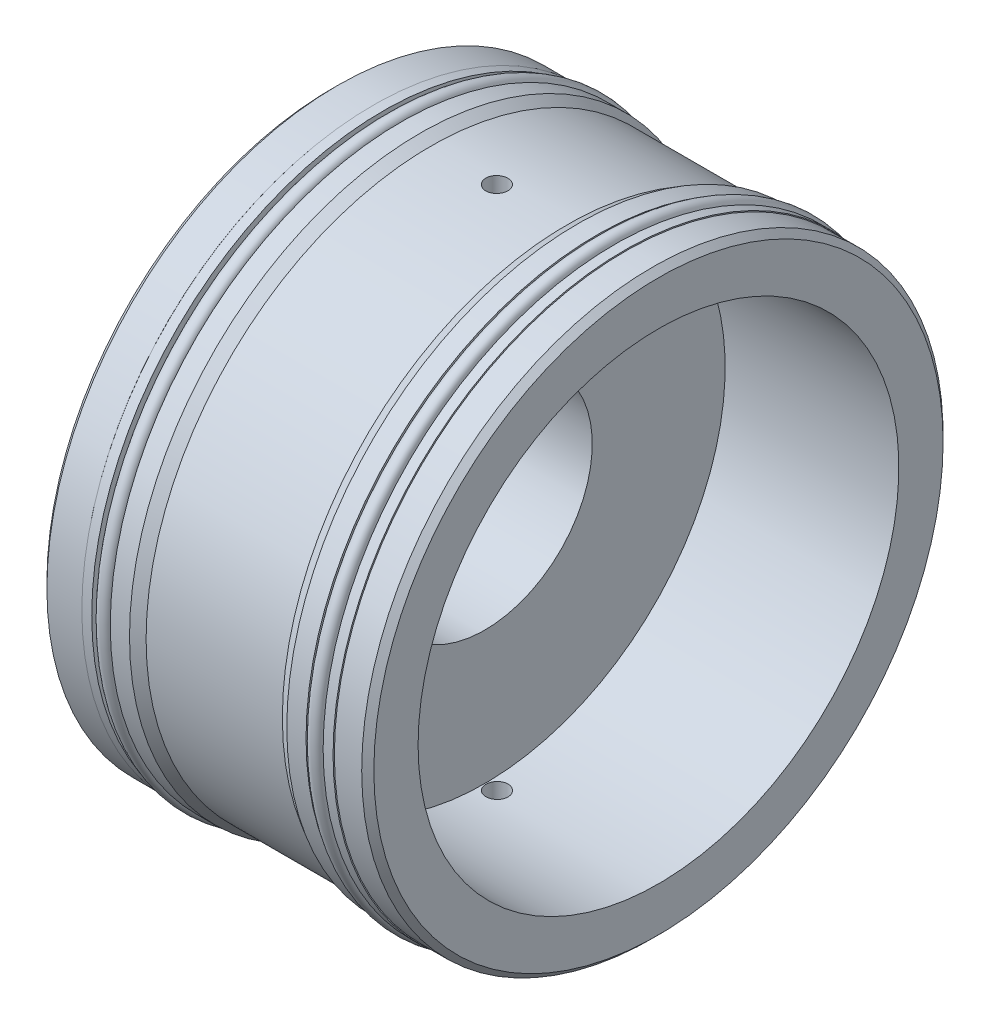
SolidWorks part; units mm, degrees
ref_plane "Front Plane" through (0, 0, 0) normal (0, 0, 1) x (1, 0, 0)
ref_plane "Top Plane" through (0, 0, 0) normal (0, 1, 0) x (1, 0, 0)
ref_plane "Right Plane" through (0, 0, 0) normal (1, 0, 0) x (0, 0, -1)
sketch "Sketch1" plane through (0, 0, 0) normal (0, 0, 1) x (1, 0, 0)
  line L0 (0, 0) -> (0, 45.5562) construction
  line L1 (0, 0) -> (32.8567, 0) construction
  line L2 (-20.5105, 13.4874) -> (-20.5105, 36.4744)
  line L3 (-20.5105, 36.4744) -> (-15.3543, 36.4744)
  line L4 (-15.3543, 36.4744) -> (-15.3543, 35.2171)
  line L5 (-15.3543, 35.2171) -> (-11.7983, 35.2171)
  line L6 (-11.7983, 35.2171) -> (-11.7983, 36.4744)
  line L7 (-11.7983, 36.4744) -> (-9.3853, 36.4744)
  line L8 (-9.3853, 36.4744) -> (-9.3853, 35.7124)
  line L9 (-9.3853, 35.7124) -> (10.3505, 35.7124)
  line L10 (-20.5105, 13.4874) -> (-1.2827, 13.4874)
  line L11 (-1.2827, 13.4874) -> (-1.2827, 30.1625)
  line L12 (-1.2827, 30.1625) -> (20.5105, 30.1625)
  line L13 (10.3505, 36.4744) -> (10.3505, 35.7124)
  line L14 (12.7635, 36.4744) -> (10.3505, 36.4744)
  line L15 (12.7635, 35.2171) -> (12.7635, 36.4744)
  line L16 (16.3195, 35.2171) -> (12.7635, 35.2171)
  line L17 (16.3195, 36.4744) -> (16.3195, 35.2171)
  line L18 (20.5105, 36.4744) -> (16.3195, 36.4744)
  line L19 (20.5105, 36.4744) -> (20.5105, 30.1625)
  dimension "D2" = 3.556
  dimension "D3" = 19.7358
  dimension "D4" = 72.9488
  dimension "D5" = 41.021
  dimension "D6" = 60.325
  dimension "D7" = 21.7932
  dimension "D8" = 71.4248
  dimension "D9" = 70.4342
  dimension "D10" = 26.9748
  dimension "D11" = 35.8648
  dimension "D12" = 2.413
  dimension "D13" = 2.413
revolve "Revolve1" add sketch "Sketch1" angle 360 about L1
chamfer "Chamfer1" distance 0.762 angle 45 2 edges at (20.5105, 0, 36.4744) (-20.5105, 0, 36.4744)
sketch "Sketch6" plane through (0, 0, 0) normal (0, 0, 1) x (1, 0, 0)
  line L0 (0, 0) -> (49.5791, 0) construction
  line L1 (-20.5105, 35.7124) -> (-20.5105, -35.7124) construction
  line L2 (-11.7983, 35.2171) -> (-15.3543, 35.2171) construction
  line L3 (-15.2781, 35.2171) -> (-14.0335, 35.2171)
  line L4 (-15.2781, 35.2171) -> (-15.2781, 36.5633)
  line L5 (-15.2781, 36.5633) -> (-14.0335, 36.5633)
  line L6 (-14.0335, 35.2171) -> (-14.0335, 36.5633)
  line L7 (0.4826, 41.4439) -> (0.4826, -9.3524) construction
  line L8 (-15.3543, -36.4744) -> (-15.3543, 36.4744) construction
  line L9 (16.3195, 35.2171) -> (16.3195, -35.2171) construction
  line L10 (-11.7983, 36.4744) -> (-11.7983, -36.4744) construction
  line L11 (14.9987, 35.2171) -> (14.9987, 36.5633)
  line L12 (16.2433, 36.5633) -> (14.9987, 36.5633)
  line L13 (16.2433, 35.2171) -> (16.2433, 36.5633)
  line L14 (16.2433, 35.2171) -> (14.9987, 35.2171)
  circle A0 centre (-12.7635, 36.0299) radius 0.889
  circle A1 centre (13.7287, 36.0299) radius 0.889
  dimension "D4" = 1.778
  dimension "D5" = 72.0598
  dimension "D6" = 0.9652
  dimension "D1" = 1.2446
  dimension "D2" = 5.2324
  dimension "D3" = 73.1266
revolve "Revolve3" add sketch "Sketch6" angle 360 about L0
sketch "Sketch7" plane through (0, 0, 0) normal (0, 1, 0) x (0, 0, -1)
  line L1 (-35.7124, -20.5105) -> (35.7124, -20.5105) construction
  circle A0 centre (0, -0.2413) radius 1.3843
  dimension "D1" = 2.7686
  dimension "D2" = 20.2692
extrude "Cut-Extrude1" cut sketch "Sketch7" against normal through all and the other way through all
sketch "Sketch8" plane through (0, 0, 0) normal (0, 0, 1) x (1, 0, 0)
  line L0 (-9.3853, 36.4744) -> (-9.3853, 35.7124)
  line L1 (-9.3853, -36.4744) -> (-9.3853, 36.4744) construction
  line L2 (-1.143, 35.7124) -> (-9.3853, 35.7124) construction
  line L3 (-9.3853, 35.7124) -> (-8.0655, 35.7124)
  line L4 (-8.0655, 35.7124) -> (-9.3853, 36.4744)
  line L5 (0, 0) -> (23.2012, 0) construction
  line L6 (0.4826, 31.5075) -> (0.4826, -4.3873) construction
  line L7 (10.3505, 35.7124) -> (10.3505, -35.7124) construction
  line L8 (9.0307, 35.7124) -> (10.3505, 36.4744)
  line L9 (10.3505, 35.7124) -> (9.0307, 35.7124)
  line L10 (10.3505, 36.4744) -> (10.3505, 35.7124)
  line L11 (12.7635, 36.4744) -> (10.3505, 36.4744) construction
  dimension "D1" = 30
revolve "Revolve4" add sketch "Sketch8" angle 360 about L5
